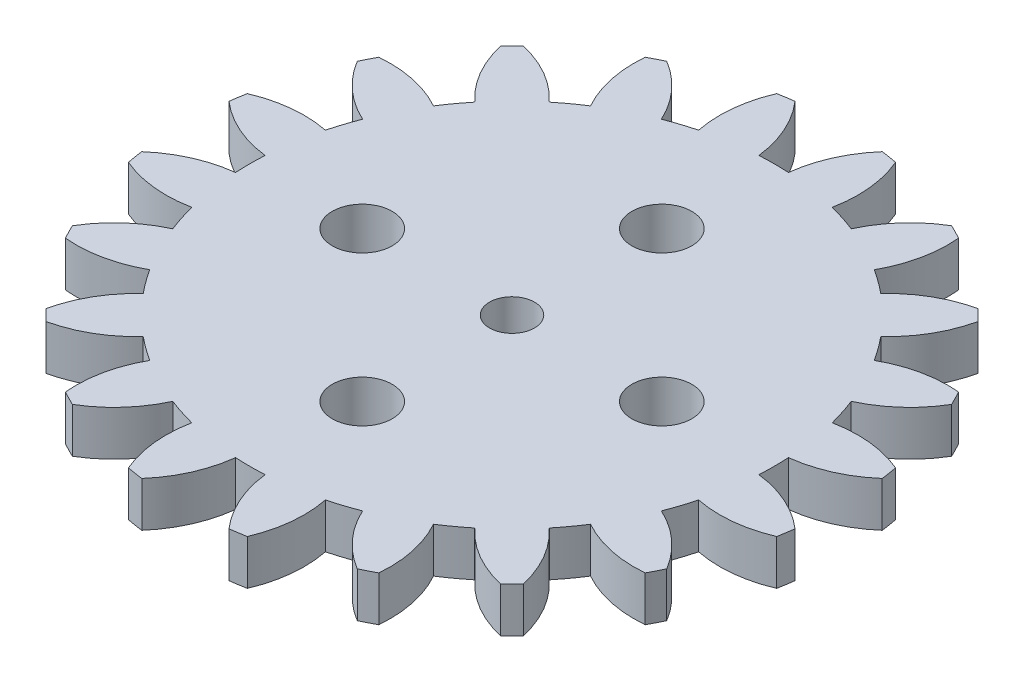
SolidWorks part; units mm, degrees
ref_plane "前视基准面" through (0, 0, 0) normal (0, 0, 1) x (1, 0, 0)
ref_plane "上视基准面" through (0, 0, 0) normal (0, 1, 0) x (1, 0, 0)
ref_plane "右视基准面" through (0, 0, 0) normal (1, 0, 0) x (0, 0, -1)
sketch "草图1" plane through (0, 0, 0) normal (0, 1, 0) x (1, 0, 0)
  arc A0 (-33.7598, 23.8313) -> (-29.4247, 21.9048) centre (-28.4895, 29.85) ccw
  arc A1 (-29.4247, 21.9048) -> (-29.4247, 19.9325) centre (-11.9535, 20.9186) ccw
  arc A2 (-29.4247, 19.9325) -> (-33.7598, 18.0059) centre (-28.4895, 11.9873) ccw
  arc A3 (-33.7598, 18.0059) -> (-33.5926, 16.9503) centre (-11.9535, 20.9186) ccw
  arc A4 (-33.5926, 16.9503) -> (-28.8743, 16.4577) centre (-30.4401, 24.3029) ccw
  arc A5 (-28.8743, 16.4577) -> (-28.2649, 14.5818) centre (-11.9535, 20.9186) ccw
  arc A6 (-28.2649, 14.5818) -> (-31.7925, 11.41) centre (-24.9203, 7.3145) ccw
  arc A7 (-31.7925, 11.41) -> (-31.3072, 10.4576) centre (-11.9535, 20.9186) ccw
  arc A8 (-31.3072, 10.4576) -> (-26.6677, 11.4472) centre (-30.5811, 18.4246) ccw
  arc A9 (-26.6677, 11.4472) -> (-25.5083, 9.8515) centre (-11.9535, 20.9186) ccw
  arc A10 (-25.5083, 9.8515) -> (-27.8832, 5.7448) centre (-20.0817, 3.9734) ccw
  arc A11 (-27.8832, 5.7448) -> (-27.1274, 4.989) centre (-11.9535, 20.9186) ccw
  arc A12 (-27.1274, 4.989) -> (-23.0206, 7.3638) centre (-28.8987, 12.7904) ccw
  arc A13 (-23.0206, 7.3638) -> (-21.425, 6.2045) centre (-11.9535, 20.9186) ccw
  arc A14 (-21.425, 6.2045) -> (-22.4145, 1.5649) centre (-14.4476, 2.291) ccw
  arc A15 (-22.4145, 1.5649) -> (-21.4622, 1.0797) centre (-11.9535, 20.9186) ccw
  arc A16 (-21.4622, 1.0797) -> (-18.2903, 4.6073) centre (-25.5576, 7.9519) ccw
  arc A17 (-18.2903, 4.6073) -> (-16.4145, 3.9978) centre (-11.9535, 20.9186) ccw
  arc A18 (-16.4145, 3.9978) -> (-15.9219, -0.7205) centre (-8.5692, 2.432) ccw
  arc A19 (-15.9219, -0.7205) -> (-14.8662, -0.8877) centre (-11.9535, 20.9186) ccw
  arc A20 (-14.8662, -0.8877) -> (-12.9397, 3.4475) centre (-20.8848, 4.3826) ccw
  arc A21 (-12.9397, 3.4475) -> (-10.9673, 3.4475) centre (-11.9535, 20.9186) ccw
  arc A22 (-10.9673, 3.4475) -> (-9.0408, -0.8877) centre (-3.0222, 4.3826) ccw
  arc A23 (-9.0408, -0.8877) -> (-7.9851, -0.7205) centre (-11.9535, 20.9186) ccw
  arc A24 (-7.9851, -0.7205) -> (-7.4925, 3.9978) centre (-15.3378, 2.432) ccw
  arc A25 (-7.4925, 3.9978) -> (-5.6167, 4.6073) centre (-11.9535, 20.9186) ccw
  arc A26 (-5.6167, 4.6073) -> (-2.4448, 1.0797) centre (1.6506, 7.9519) ccw
  arc A27 (-2.4448, 1.0797) -> (-1.4925, 1.5649) centre (-11.9535, 20.9186) ccw
  arc A28 (-1.4925, 1.5649) -> (-2.482, 6.2045) centre (-9.4595, 2.291) ccw
  arc A29 (-2.482, 6.2045) -> (-0.8864, 7.3638) centre (-11.9535, 20.9186) ccw
  arc A30 (-0.8864, 7.3638) -> (3.2204, 4.989) centre (4.9917, 12.7904) ccw
  arc A31 (3.2204, 4.989) -> (3.9761, 5.7448) centre (-11.9535, 20.9186) ccw
  arc A32 (3.9761, 5.7448) -> (1.6013, 9.8515) centre (-3.8253, 3.9734) ccw
  arc A33 (1.6013, 9.8515) -> (2.7606, 11.4472) centre (-11.9535, 20.9186) ccw
  arc A34 (2.7606, 11.4472) -> (7.4002, 10.4576) centre (6.6741, 18.4246) ccw
  arc A35 (7.4002, 10.4576) -> (7.8855, 11.41) centre (-11.9535, 20.9186) ccw
  arc A36 (7.8855, 11.41) -> (4.3578, 14.5818) centre (1.0133, 7.3145) ccw
  arc A37 (4.3578, 14.5818) -> (4.9673, 16.4577) centre (-11.9535, 20.9186) ccw
  arc A38 (4.9673, 16.4577) -> (9.6856, 16.9503) centre (6.5331, 24.3029) ccw
  arc A39 (9.6856, 16.9503) -> (9.8528, 18.0059) centre (-11.9535, 20.9186) ccw
  arc A40 (9.8528, 18.0059) -> (5.5177, 19.9325) centre (4.5825, 11.9873) ccw
  arc A41 (5.5177, 19.9325) -> (5.5177, 21.9048) centre (-11.9535, 20.9186) ccw
  arc A42 (5.5177, 21.9048) -> (9.8528, 23.8313) centre (4.5825, 29.85) ccw
  arc A43 (9.8528, 23.8313) -> (9.6856, 24.887) centre (-11.9535, 20.9186) ccw
  arc A44 (9.6856, 24.887) -> (4.9673, 25.3796) centre (6.5331, 17.5344) ccw
  arc A45 (4.9673, 25.3796) -> (4.3578, 27.2554) centre (-11.9535, 20.9186) ccw
  arc A46 (4.3578, 27.2554) -> (7.8855, 30.4273) centre (1.0133, 34.5228) ccw
  arc A47 (7.8855, 30.4273) -> (7.4002, 31.3797) centre (-11.9535, 20.9186) ccw
  arc A48 (7.4002, 31.3797) -> (2.7606, 30.3901) centre (6.6741, 23.4127) ccw
  arc A49 (2.7606, 30.3901) -> (1.6013, 31.9858) centre (-11.9535, 20.9186) ccw
  arc A50 (1.6013, 31.9858) -> (3.9761, 36.0925) centre (-3.8253, 37.8639) ccw
  arc A51 (3.9761, 36.0925) -> (3.2204, 36.8483) centre (-11.9535, 20.9186) ccw
  arc A52 (3.2204, 36.8483) -> (-0.8864, 34.4735) centre (4.9917, 29.0469) ccw
  arc A53 (-0.8864, 34.4735) -> (-2.482, 35.6328) centre (-11.9535, 20.9186) ccw
  arc A54 (-2.482, 35.6328) -> (-1.4925, 40.2724) centre (-9.4595, 39.5463) ccw
  arc A55 (-1.4925, 40.2724) -> (-2.4448, 40.7576) centre (-11.9535, 20.9186) ccw
  arc A56 (-2.4448, 40.7576) -> (-5.6167, 37.23) centre (1.6506, 33.8854) ccw
  arc A57 (-5.6167, 37.23) -> (-7.4925, 37.8395) centre (-11.9535, 20.9186) ccw
  arc A58 (-7.4925, 37.8395) -> (-7.9851, 42.5578) centre (-15.3378, 39.4053) ccw
  arc A59 (-7.9851, 42.5578) -> (-9.0408, 42.725) centre (-11.9535, 20.9186) ccw
  arc A60 (-9.0408, 42.725) -> (-10.9673, 38.3898) centre (-3.0222, 37.4547) ccw
  arc A61 (-10.9673, 38.3898) -> (-12.9397, 38.3898) centre (-11.9535, 20.9186) ccw
  arc A62 (-12.9397, 38.3898) -> (-14.8662, 42.725) centre (-20.8848, 37.4547) ccw
  arc A63 (-14.8662, 42.725) -> (-15.9219, 42.5578) centre (-11.9535, 20.9186) ccw
  arc A64 (-15.9219, 42.5578) -> (-16.4145, 37.8395) centre (-8.5692, 39.4053) ccw
  arc A65 (-16.4145, 37.8395) -> (-18.2903, 37.23) centre (-11.9535, 20.9186) ccw
  arc A66 (-18.2903, 37.23) -> (-21.4622, 40.7576) centre (-25.5576, 33.8854) ccw
  arc A67 (-21.4622, 40.7576) -> (-22.4145, 40.2724) centre (-11.9535, 20.9186) ccw
  arc A68 (-22.4145, 40.2724) -> (-21.425, 35.6328) centre (-14.4476, 39.5463) ccw
  arc A69 (-21.425, 35.6328) -> (-23.0206, 34.4735) centre (-11.9535, 20.9186) ccw
  arc A70 (-23.0206, 34.4735) -> (-27.1274, 36.8483) centre (-28.8987, 29.0469) ccw
  arc A71 (-27.1274, 36.8483) -> (-27.8832, 36.0925) centre (-11.9535, 20.9186) ccw
  arc A72 (-27.8832, 36.0925) -> (-25.5083, 31.9858) centre (-20.0817, 37.8639) ccw
  arc A73 (-25.5083, 31.9858) -> (-26.6677, 30.3901) centre (-11.9535, 20.9186) ccw
  arc A74 (-26.6677, 30.3901) -> (-31.3072, 31.3797) centre (-30.5811, 23.4127) ccw
  arc A75 (-31.3072, 31.3797) -> (-31.7925, 30.4273) centre (-11.9535, 20.9186) ccw
  arc A76 (-31.7925, 30.4273) -> (-28.2649, 27.2554) centre (-24.9203, 34.5228) ccw
  arc A77 (-28.2649, 27.2554) -> (-28.8743, 25.3796) centre (-11.9535, 20.9186) ccw
  arc A78 (-28.8743, 25.3796) -> (-33.5926, 24.887) centre (-30.4401, 17.5344) ccw
  arc A79 (-33.5926, 24.887) -> (-33.7598, 23.8313) centre (-11.9535, 20.9186) ccw
extrude "凸台-拉伸1" add sketch "草图1" along normal blind 3
sketch "草图2" plane through (0, 3, 0) normal (0, 1, 0) x (1, 0, 0)
  circle A0 centre (-11.9535, 20.9186) radius 1.5
extrude "切除-拉伸1" cut sketch "草图2" against normal blind 3
sketch "草图3" plane through (0, 3, 0) normal (0, 1, 0) x (1, 0, 0)
  circle A0 centre (-11.9535, 20.9186) radius 10 construction
  circle A1 centre (-11.9535, 30.9186) radius 2
  circle A2 centre (-1.9535, 20.9186) radius 2
  circle A3 centre (-11.9535, 10.9186) radius 2
  circle A4 centre (-21.9535, 20.9186) radius 2
  point P14 (-11.9535, 20.9186)
  dimension "D1" = 4
extrude "切除-拉伸2" cut sketch "草图3" against normal blind 10
